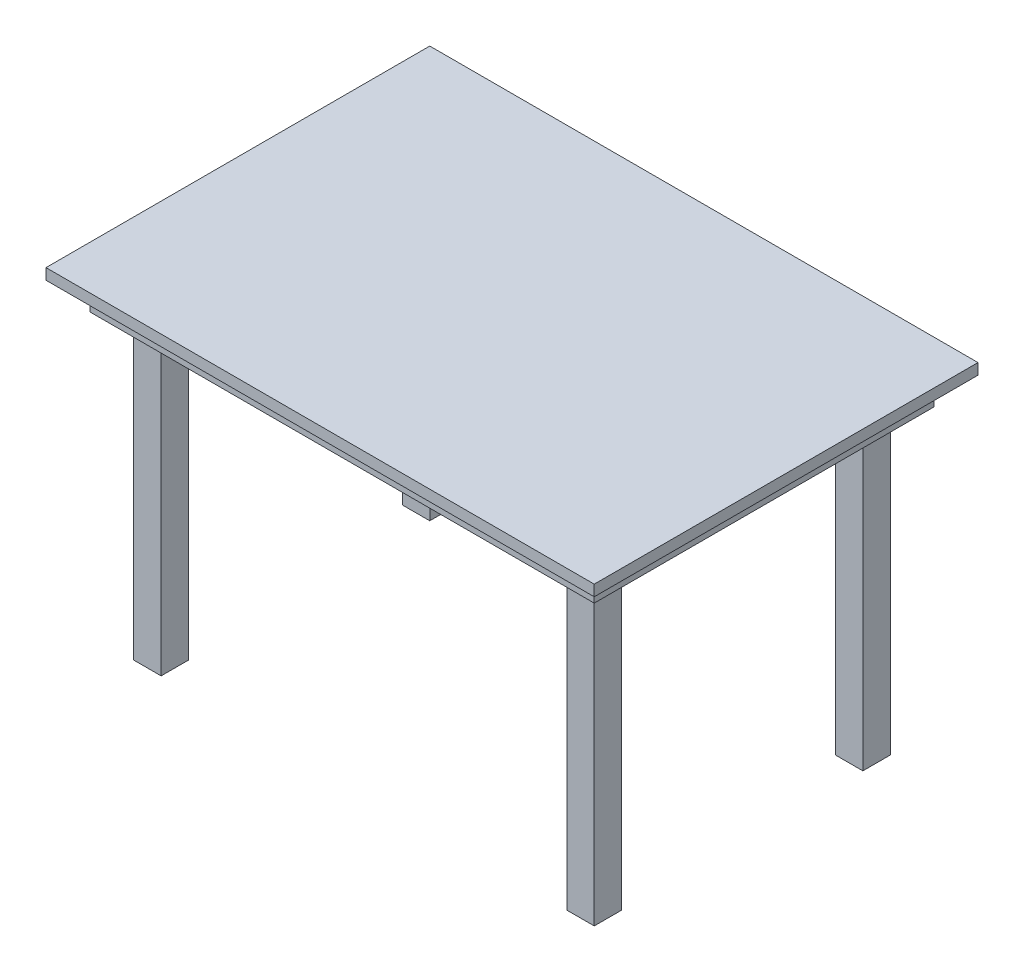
SolidWorks part; units mm, degrees
ref_plane "Front Plane" through (0, 0, 0) normal (0, 0, 1) x (1, 0, 0)
ref_plane "Top Plane" through (0, 0, 0) normal (0, 1, 0) x (1, 0, 0)
ref_plane "Right Plane" through (0, 0, 0) normal (1, 0, 0) x (0, 0, -1)
sketch "Sketch1" plane through (0, 0, 0) normal (0, 1, 0) x (1, 0, 0)
  line L1 (0, 0) -> (1000, 0)
  line L2 (0, 0) -> (0, 700)
  line L3 (0, 700) -> (1000, 700)
  line L4 (1000, 0) -> (1000, 700)
  dimension "D1" = 1000
  dimension "D2" = 700
extrude "Boss-Extrude1" add sketch "Sketch1" along normal blind 20
sketch "Sketch2" plane through (0, 0, 0) normal (0, -1, 0) x (1, 0, 0)
  line L24 (920, -80) -> (80, -80)
  line L25 (80, -80) -> (80, -620)
  line L26 (80, -620) -> (920, -620)
  line L27 (920, -620) -> (920, -80)
  line L28 (40, -40) -> (40, -660)
  line L29 (40, -660) -> (960, -660)
  line L30 (960, -660) -> (960, -40)
  line L31 (960, -40) -> (40, -40)
  line L32 (40, -40) -> (40, -660)
  line L33 (40, -660) -> (960, -660)
  line L34 (960, -660) -> (960, -40)
  line L35 (960, -40) -> (40, -40)
  dimension "D1" = 40
  dimension "D2" = 40
extrude "Boss-Extrude3" add sketch "Sketch2" along normal blind 50
sketch "Sketch3" plane through (0, 0, 0) normal (0, -1, 0) x (1, 0, 0)
  line L1 (80, -80) -> (130, -80)
  line L2 (80, -80) -> (80, -130)
  line L3 (80, -130) -> (130, -130)
  line L4 (130, -80) -> (130, -130)
  line L5 (920, -80) -> (870, -80)
  line L6 (920, -80) -> (920, -130)
  line L7 (920, -130) -> (870, -130)
  line L8 (870, -80) -> (870, -130)
  line L9 (920, -620) -> (870, -620)
  line L10 (920, -620) -> (920, -570)
  line L11 (920, -570) -> (870, -570)
  line L12 (870, -620) -> (870, -570)
  line L13 (80, -620) -> (130, -620)
  line L14 (80, -620) -> (80, -570)
  line L15 (80, -570) -> (130, -570)
  line L16 (130, -620) -> (130, -570)
  dimension "D1" = 50
extrude "Boss-Extrude4" add sketch "Sketch3" along normal blind 600
